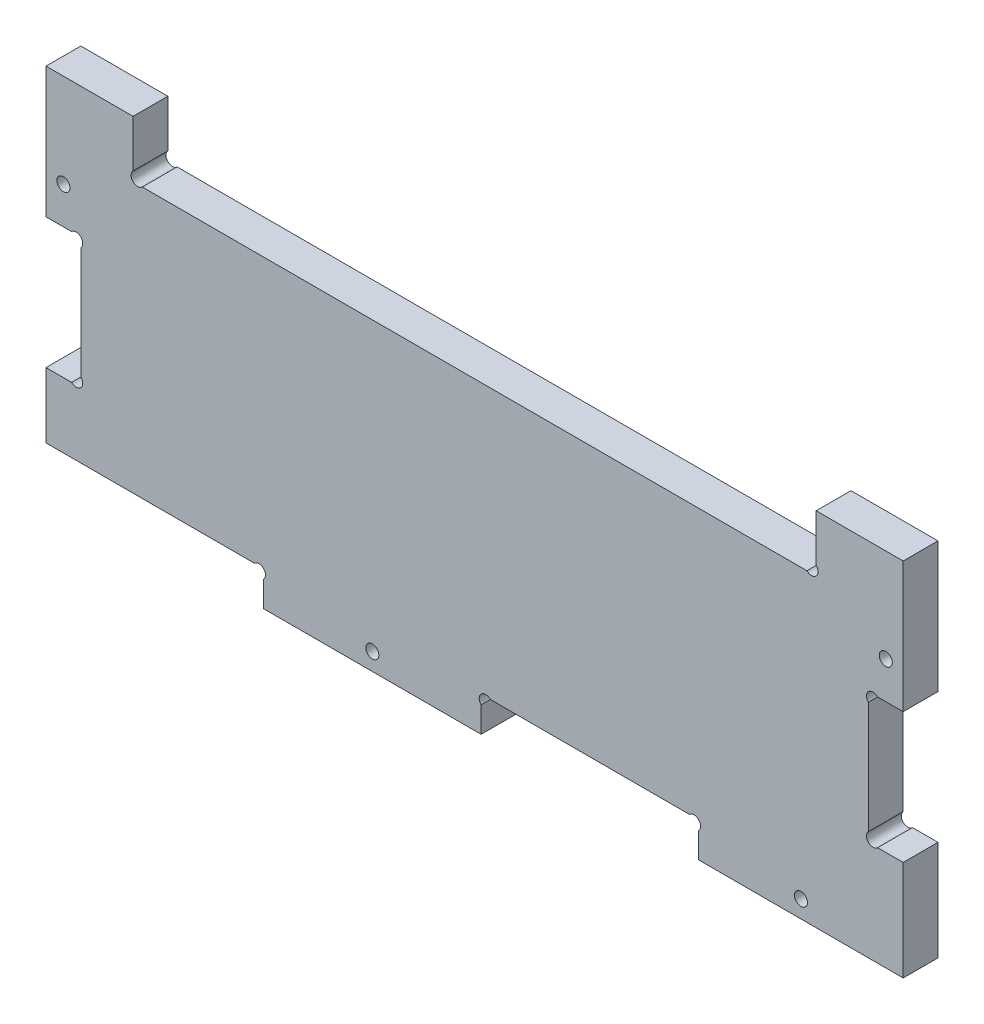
SolidWorks part; units mm, degrees
ref_plane "Plan de face" through (0, 0, 0) normal (0, 0, 1) x (1, 0, 0)
ref_plane "Plan de dessus" through (0, 0, 0) normal (0, 1, 0) x (1, 0, 0)
ref_plane "Plan de droite" through (0, 0, 0) normal (1, 0, 0) x (0, 0, -1)
sketch "Esquisse1" plane through (0, 0, 0) normal (0, 0, 1) x (1, 0, 0)
  line L0 (-176.8157, 28.3831) -> (-176.8157, 45.3831)
  line L1 (-176.8157, 45.3831) -> (-176.8157, 58.3831)
  line L2 (-176.8157, -16.6169) -> (-176.8157, -1.6169)
  line L3 (-176.8157, 58.3831) -> (-156.8157, 58.3831)
  line L4 (20.1843, 28.3831) -> (14.3056, 28.3831)
  line L5 (12.1843, 26.2618) -> (12.1843, 0.5044)
  line L6 (14.3056, -1.6169) -> (20.1843, -1.6169)
  line L7 (-154.6944, 45.3831) -> (-1.937, 45.3831)
  line L8 (-156.8157, 45.3831) -> (-136.0043, 66.1945) construction
  line L9 (20.1843, -18.7382) -> (20.1843, -24.6169)
  line L10 (-126.8157, -24.6169) -> (-76.8157, -16.6169) construction
  line L11 (-176.8157, -24.6169) -> (-126.8157, -24.6169) construction
  line L12 (20.1843, -24.6169) -> (-26.8157, -24.6169)
  line L13 (-26.8157, -24.6169) -> (-26.8157, -18.7382)
  line L14 (-74.6944, -16.6169) -> (-28.937, -16.6169)
  line L15 (-26.8157, -24.6169) -> (20.1843, -16.6169) construction
  line L16 (-76.8157, -18.7382) -> (-76.8157, -24.6169)
  line L17 (-76.8157, -24.6169) -> (-126.8157, -24.6169)
  line L18 (-126.8157, -24.6169) -> (-126.8157, -18.7382)
  line L19 (-128.937, -16.6169) -> (-176.8157, -16.6169)
  line L20 (-176.8157, 28.3831) -> (-168.8157, 45.3831) construction
  line L21 (0.1843, 45.3831) -> (-17.5748, 63.1422) construction
  line L22 (20.1843, -1.6169) -> (20.1843, -16.6169)
  line L23 (12.1843, 28.3831) -> (20.1843, 45.3831) construction
  line L25 (-176.8157, -1.6169) -> (-170.937, -1.6169)
  line L27 (-168.8157, 0.5044) -> (-168.8157, 26.2618)
  line L28 (-170.937, 28.3831) -> (-176.8157, 28.3831)
  line L29 (20.1843, 45.3831) -> (20.1843, 28.3831)
  line L31 (-156.8157, 58.3831) -> (-156.8157, 47.5044)
  line L32 (20.1843, -16.6169) -> (20.1843, -18.7382)
  line L33 (12.1843, 28.3831) -> (22.8383, 17.7291) construction
  line L34 (12.1843, -1.6169) -> (25.2237, 11.4225) construction
  line L35 (20.1843, 45.3831) -> (20.1843, 58.3831)
  line L36 (20.1843, 58.3831) -> (0.1843, 58.3831)
  line L37 (0.1843, 58.3831) -> (0.1843, 47.5044)
  arc A0 (14.3056, 28.3831) -> (12.1843, 26.2618) centre (13.245, 27.3225) ccw
  arc A1 (-126.8157, -18.7382) -> (-128.937, -16.6169) centre (-127.8763, -17.6775) ccw
  arc A2 (-74.6944, -16.6169) -> (-76.8157, -18.7382) centre (-75.755, -17.6775) ccw
  arc A3 (-26.8157, -18.7382) -> (-28.937, -16.6169) centre (-27.8763, -17.6775) ccw
  arc A4 (12.1843, 0.5044) -> (14.3056, -1.6169) centre (13.245, -0.5562) ccw
  arc A5 (-170.937, -1.6169) -> (-168.8157, 0.5044) centre (-169.8763, -0.5562) ccw
  arc A6 (-168.8157, 26.2618) -> (-170.937, 28.3831) centre (-169.8763, 27.3225) ccw
  arc A7 (-156.8157, 47.5044) -> (-154.6944, 45.3831) centre (-155.755, 46.4438) ccw
  arc A8 (-1.937, 45.3831) -> (0.1843, 47.5044) centre (-0.8763, 46.4438) ccw
  circle A9 centre (-101.8157, -20.6169) radius 1.5
  circle A10 centre (-3.3157, -20.6169) radius 1.5
  circle A11 centre (-172.8157, 36.8831) radius 1.5
  circle A12 centre (16.1843, 36.8831) radius 1.5
  dimension "D1" = 50
  dimension "D8" = 45
  dimension "D10" = 8
  dimension "D2" = 45
  dimension "D5" = 45
  dimension "D3" = 45
  dimension "D6" = 50
  dimension "D7" = 50
  dimension "D11" = 8
  dimension "D13" = 8
  dimension "D14" = 20
  dimension "D15" = 20
extrude "Boss.-Extru.1" add sketch "Esquisse1" along normal blind 8
